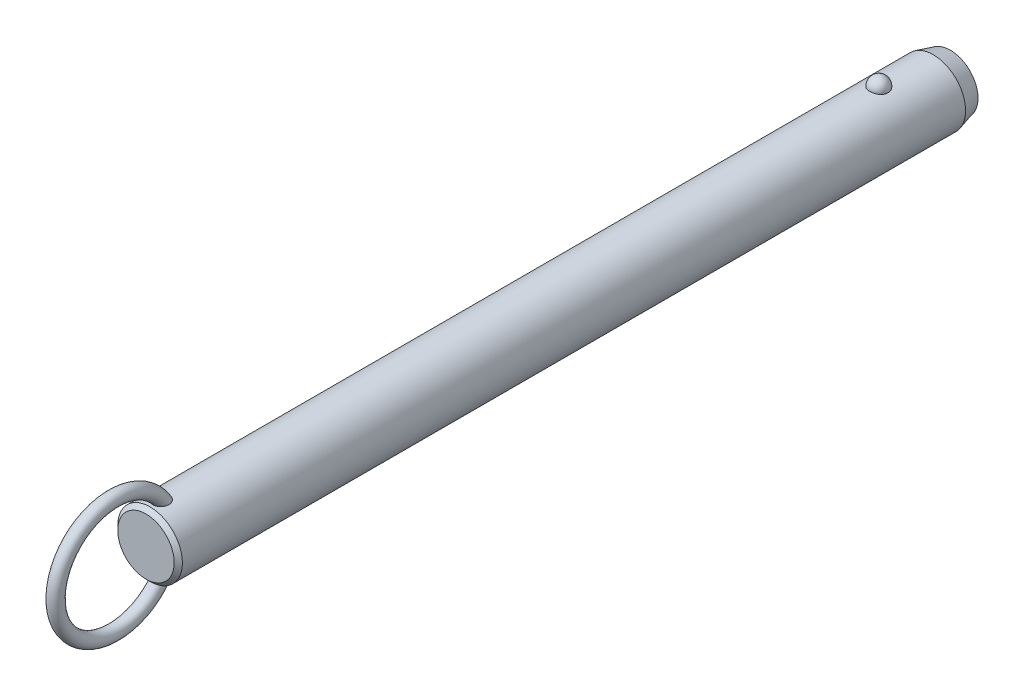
SolidWorks part; units mm, degrees
ref_plane "Front Plane" through (0, 0, 0) normal (0, 0, 1) x (1, 0, 0)
ref_plane "Top Plane" through (0, 0, 0) normal (0, 1, 0) x (1, 0, 0)
ref_plane "Right Plane" through (0, 0, 0) normal (1, 0, 0) x (0, 0, -1)
sketch "Sketch2" plane through (0, 0, 0) normal (0, 0, 1) x (1, 0, 0)
  circle A0 centre (0, 0) radius 9.5
  point P3 (0, 9.5)
  dimension "D1" = 19
extrude "Boss-Extrude1" add sketch "Sketch2" along normal blind 203.2
sketch "Sketch3" plane through (0, 0, 0) normal (0, 0, -1) x (-1, 0, 0)
  circle A0 centre (0, 0) radius 9.5
  dimension "D1" = 19
extrude "Boss-Extrude2" add sketch "Sketch3" along normal blind 23.7
chamfer "Chamfer1" distance 5 angle 15 1 edges at (-9.5, 0, -23.7)
sketch "Sketch12" plane through (0, 0, 0) normal (1, 0, 0) x (0, 0, -1)
  line L0 (-203.2, 9.5) -> (-203.2, -9.5) construction
  point P0 (-203.2, 0)
sketch "Sketch13" plane through (0, 0, 0) normal (1, 0, 0) x (0, 0, -1)
  circle A0 centre (-222.25, 0) radius 19.05
  point P2 (-203.2, 0)
  dimension "D1" = 38.1
sketch "Sketch14" plane through (0, 0, 0) normal (0, 1, 0) x (1, 0, 0)
  circle A0 centre (0, -205.2) radius 2
  point P2 (0, -203.2)
  dimension "D1" = 4
sweep "Sweep1" add profiles "Sketch14" path "Sketch13"
sketch "Sketch15" plane through (0, 0, 203.2) normal (0, 0, 1) x (1, 0, 0)
  circle A0 centre (0, 0) radius 9.5
  dimension "D1" = 19
extrude "Boss-Extrude3" add sketch "Sketch15" along normal blind 9.52
chamfer "Chamfer2" distance 1.2 angle 45 1 edges at (9.5, 0, 212.72)
sketch "Sketch18" plane through (0, 0, 0) normal (1, 0, 0) x (0, 0, -1)
  line L0 (18.7, 9.5) -> (-205.7378, 9.5) construction
  line L1 (2.7, 12.2) -> (2.7, 6.8)
  line L2 (-205.7378, -9.5) -> (18.7, -9.5) construction
  arc A0 (2.7, 12.2) -> (2.7, 6.8) centre (2.7, 9.5) ccw
  point P4 (0, 9.5)
  dimension "D1" = 21.7
revolve "Revolve1" add sketch "Sketch18" angle 360 about L1
